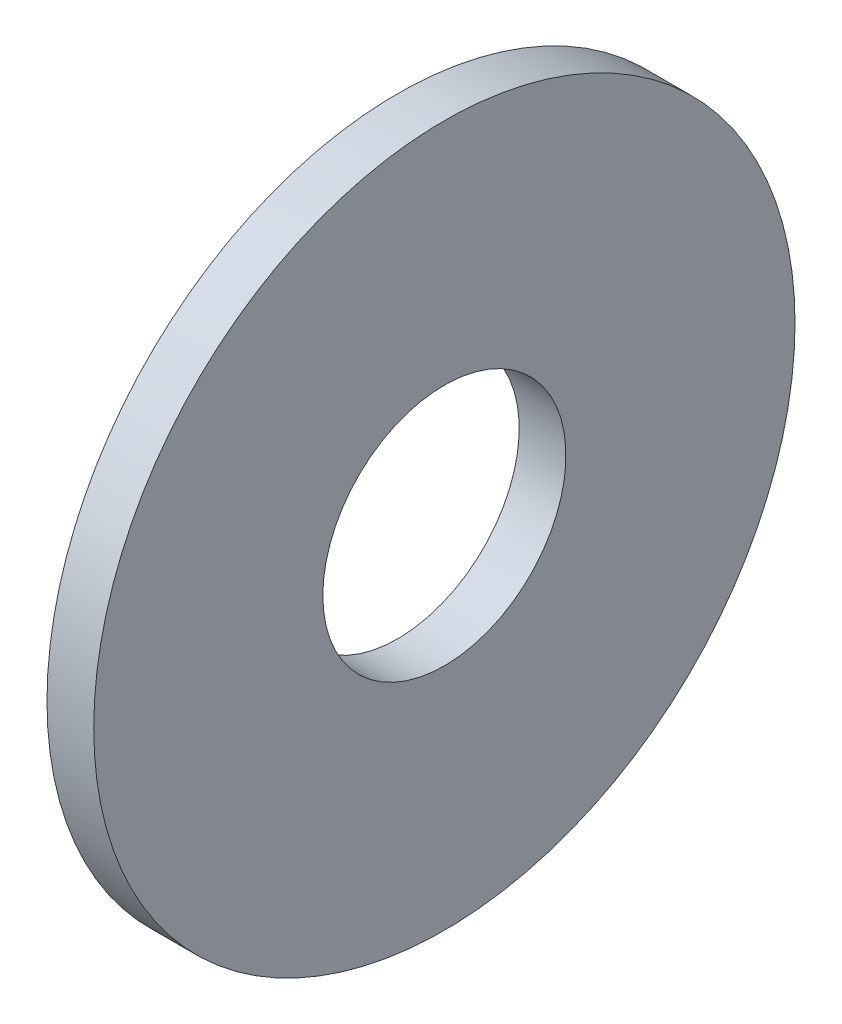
SolidWorks part; units mm, degrees
ref_plane "Plan de face" through (0, 0, 0) normal (0, 0, 1) x (1, 0, 0)
ref_plane "Plan de dessus" through (0, 0, 0) normal (0, 1, 0) x (1, 0, 0)
ref_plane "Plan de droite" through (0, 0, 0) normal (1, 0, 0) x (0, 0, -1)
sketch "Esquisse2" plane through (0, 0, 0) normal (0, 0, 1) x (1, 0, 0)
  line L0 (-7.4558, 0) -> (12.2905, 0) construction
  line L1 (2, 5.2) -> (2, 15)
  line L2 (2, 15) -> (0, 15)
  line L3 (0, 15) -> (0, 5.2)
  line L4 (0, 5.2) -> (2, 5.2)
  dimension "D1" = 15
  dimension "D2" = 5.2
  dimension "Thickness" = 2
revolve "Révolution1" add sketch "Esquisse2" angle 360 about L0
